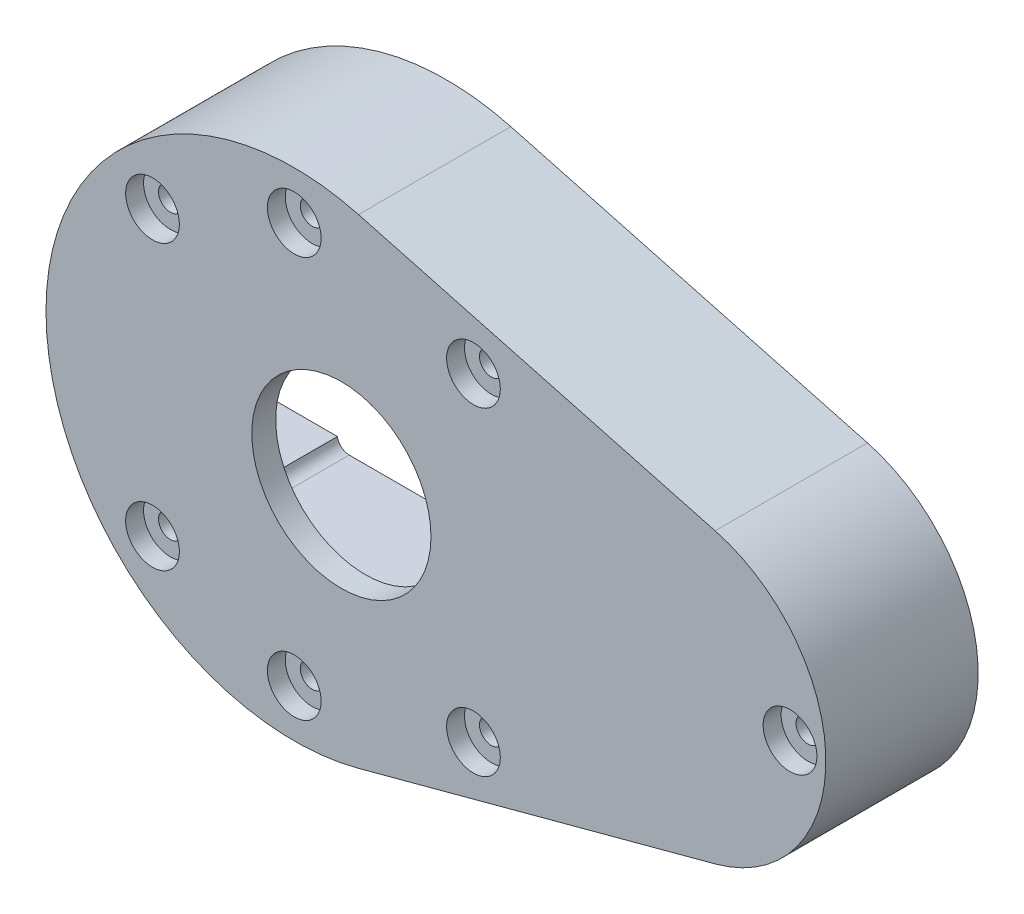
SolidWorks part; units mm, degrees
ref_plane "Front Plane" through (0, 0, 0) normal (0, 0, 1) x (1, 0, 0)
ref_plane "Top Plane" through (0, 0, 0) normal (0, 1, 0) x (1, 0, 0)
ref_plane "Right Plane" through (0, 0, 0) normal (1, 0, 0) x (0, 0, -1)
sketch "Sketch1" plane through (0, 0, 0) normal (0, 0, 1) x (1, 0, 0)
  line L0 (-6.2212, 20.0741) -> (23.6352, 12.0741) construction
  line L1 (23.6352, -12.0741) -> (-6.2212, -20.0741) construction
  line L2 (-6.2212, 20.0741) -> (23.6352, 12.0741)
  line L3 (23.6352, -12.0741) -> (-6.2212, -20.0741)
  line L33 (27.75, -6.225) -> (27.75, -7.65)
  line L34 (25.75, -9.65) -> (20.25, -9.65)
  line L35 (27.75, -6.225) -> (27.75, -7.65)
  line L36 (25.75, -9.65) -> (20.7387, -9.65)
  line L40 (20.25, 9.65) -> (25.75, 9.65)
  line L41 (27.75, 7.65) -> (27.75, 6.225)
  line L42 (20.7387, 9.65) -> (25.75, 9.65)
  line L43 (27.75, 7.65) -> (27.75, -6.225)
  line L51 (-12.24, -10.5) -> (-10.25, -10.5)
  line L52 (-10.25, -10.5) -> (-8.26, -10.5)
  line L53 (-8.26, -10.5) -> (19.75, -10.5)
  line L54 (-12.24, -10.5) -> (-10.25, -10.5)
  line L55 (-10.25, -10.5) -> (-8.26, -10.5)
  line L56 (-8.26, -10.5) -> (19.75, -10.5)
  line L69 (-20.75, -9.5) -> (-20.75, -1.99)
  line L70 (-12.24, -10.5) -> (-19.75, -10.5)
  line L71 (-20.75, -9.5) -> (-20.75, -1.99)
  line L72 (-12.24, -10.5) -> (-19.75, -10.5)
  line L78 (-20.25, -9.65) -> (-25.75, -9.65)
  line L79 (-20.25, -9.65) -> (-25.75, -9.65)
  line L84 (-27.75, -7.65) -> (-27.75, -6.225)
  line L85 (-27.75, -7.65) -> (-27.75, 6.225)
  line L90 (-27.75, 6.225) -> (-27.75, 7.65)
  line L91 (-25.75, 9.65) -> (-20.25, 9.65)
  line L92 (-27.75, 6.225) -> (-27.75, 7.65)
  line L93 (-25.75, 9.65) -> (-20.7387, 9.65)
  line L111 (-12.24, 10.5) -> (-19.75, 10.5)
  line L112 (-10.25, 10.5) -> (-12.24, 10.5)
  line L113 (-8.26, 10.5) -> (-10.25, 10.5)
  line L114 (19.75, 10.5) -> (-8.26, 10.5)
  line L115 (-12.24, 10.5) -> (-19.75, 10.5)
  line L116 (-10.25, 10.5) -> (-12.24, 10.5)
  line L117 (-8.26, 10.5) -> (-10.25, 10.5)
  line L118 (19.75, 10.5) -> (-8.26, 10.5)
  arc A0 (23.6352, -12.0741) -> (23.6352, 12.0741) centre (20.4, 0) ccw construction
  arc A1 (-6.2212, 20.0741) -> (-6.2212, -20.0741) centre (-11.6, 0) ccw construction
  arc A2 (23.6352, -12.0741) -> (23.6352, 12.0741) centre (20.4, 0) ccw
  arc A3 (-6.2212, 20.0741) -> (-6.2212, -20.0741) centre (-11.6, 0) ccw
  circle A4 centre (29.9, 0) radius 1 construction
  circle A5 centre (3.4, 13.355) radius 1 construction
  circle A6 centre (-11.6, 16.7822) radius 1 construction
  circle A7 centre (3.4, -13.355) radius 1 construction
  circle A8 centre (-11.6, -16.7822) radius 1 construction
  circle A9 centre (-23.4668, -11.8668) radius 1 construction
  circle A10 centre (-23.4668, 11.8668) radius 1 construction
  circle A11 centre (29.9, 0) radius 1
  circle A12 centre (3.4, 13.355) radius 1
  circle A13 centre (-11.6, 16.7822) radius 1
  circle A14 centre (3.4, -13.355) radius 1
  circle A15 centre (-11.6, -16.7822) radius 1
  circle A16 centre (-23.4668, -11.8668) radius 1
  circle A17 centre (-23.4668, 11.8668) radius 1
  arc A21 (25.75, -9.65) -> (27.75, -7.65) centre (25.75, -7.65) ccw
  arc A22 (25.75, -9.65) -> (27.75, -7.65) centre (25.75, -7.65) ccw
  arc A26 (27.75, 7.65) -> (25.75, 9.65) centre (25.75, 7.65) ccw
  arc A27 (27.75, 7.65) -> (25.75, 9.65) centre (25.75, 7.65) ccw
  arc A32 (19.75, -10.5) -> (20.75, -9.5) centre (19.75, -9.5) ccw
  arc A33 (19.75, -10.5) -> (20.7387, -9.65) centre (19.75, -9.5) ccw
  arc A41 (-20.75, -9.5) -> (-19.75, -10.5) centre (-19.75, -9.5) ccw
  arc A42 (-20.75, -9.5) -> (-19.75, -10.5) centre (-19.75, -9.5) ccw
  arc A47 (-27.75, -7.65) -> (-25.75, -9.65) centre (-25.75, -7.65) ccw
  arc A48 (-27.75, -7.65) -> (-25.75, -9.65) centre (-25.75, -7.65) ccw
  arc A52 (-25.75, 9.65) -> (-27.75, 7.65) centre (-25.75, 7.65) ccw
  arc A53 (-25.75, 9.65) -> (-27.75, 7.65) centre (-25.75, 7.65) ccw
  arc A64 (-19.75, 10.5) -> (-20.75, 9.5) centre (-19.75, 9.5) ccw
  arc A65 (20.75, 9.5) -> (19.75, 10.5) centre (19.75, 9.5) ccw
  arc A66 (-19.75, 10.5) -> (-20.7387, 9.65) centre (-19.75, 9.5) ccw
  arc A67 (20.7387, 9.65) -> (19.75, 10.5) centre (19.75, 9.5) ccw
  dimension "D1" = 0.5
  dimension "D2" = 0.5
  dimension "D3" = 0.5
  dimension "D4" = 0.5
  dimension "D6" = 0.5
  dimension "D7" = 0.5
  dimension "D8" = 0.5
  dimension "D9" = 0.5
extrude "Boss-Extrude1" add sketch "Sketch1" along normal blind 12.75 contours L2 A3 L3 A2 A67 L42 A27 L43 L35 A22 L36 A33 L56 L55 L54 L72 A42 L79 A48 L85 L92 A53 L93 A66 L115 L116 L117 L118
sketch "Sketch2" plane through (0, 0, 12.75) normal (0, 0, 1) x (1, 0, 0)
  line L2 (23.6352, 12.0741) -> (-6.2212, 20.0741)
  line L3 (-6.2212, -20.0741) -> (23.6352, -12.0741)
  line L4 (23.6352, 12.0741) -> (-6.2212, 20.0741)
  line L5 (-6.2212, -20.0741) -> (23.6352, -12.0741)
  circle A0 centre (-11.6, 16.7822) radius 1 construction
  circle A1 centre (-11.6, 16.7822) radius 1
  arc A2 (-6.2212, 20.0741) -> (-6.2212, -20.0741) centre (-11.6, 0) ccw
  arc A3 (23.6352, -12.0741) -> (23.6352, 12.0741) centre (20.4, 0) ccw
  arc A4 (-6.2212, 20.0741) -> (-6.2212, -20.0741) centre (-11.6, 0) ccw
  arc A5 (23.6352, -12.0741) -> (23.6352, 12.0741) centre (20.4, 0) ccw
  circle A6 centre (3.4, 13.355) radius 1 construction
  circle A7 centre (3.4, 13.355) radius 1
  circle A8 centre (29.9, 0) radius 1 construction
  circle A9 centre (3.4, -13.355) radius 1 construction
  circle A10 centre (-11.6, -16.7822) radius 1 construction
  circle A11 centre (-23.4668, -11.8668) radius 1 construction
  circle A12 centre (-23.4668, 11.8668) radius 1 construction
  circle A13 centre (29.9, 0) radius 1
  circle A14 centre (3.4, -13.355) radius 1
  circle A15 centre (-11.6, -16.7822) radius 1
  circle A16 centre (-23.4668, -11.8668) radius 1
  circle A17 centre (-23.4668, 11.8668) radius 1
  dimension "D1" = 0
extrude "Boss-Extrude2" add sketch "Sketch2" against normal up to surface (2 mm away)
sketch "Sketch3" plane through (0, 0, 12.75) normal (0, 0, 1) x (1, 0, 0)
  circle A0 centre (-7.6559, -0.25) radius 7.5
  dimension "D1" = 15
extrude "Cut-Extrude1" cut sketch "Sketch3" against normal through all
sketch "Sketch4" plane through (0, 0, 12.75) normal (0, 0, 1) x (1, 0, 0)
  circle A0 centre (-11.6, 16.7822) radius 2.25
  circle A1 centre (3.4, 13.355) radius 2.25
  circle A2 centre (29.9, 0) radius 2.25
  circle A3 centre (3.4, -13.355) radius 2.25
  circle A4 centre (-11.6, -16.7822) radius 2.25
  circle A5 centre (-23.4668, -11.8668) radius 2.25
  circle A6 centre (-23.4668, 11.8668) radius 2.25
  dimension "D1" = 4.5
  dimension "D2" = 4.5
  dimension "D3" = 4.5
  dimension "D4" = 4.5
  dimension "D5" = 4.5
  dimension "D6" = 4.5
  dimension "D7" = 4.5
extrude "Cut-Extrude2" cut sketch "Sketch4" against normal blind 1.5
